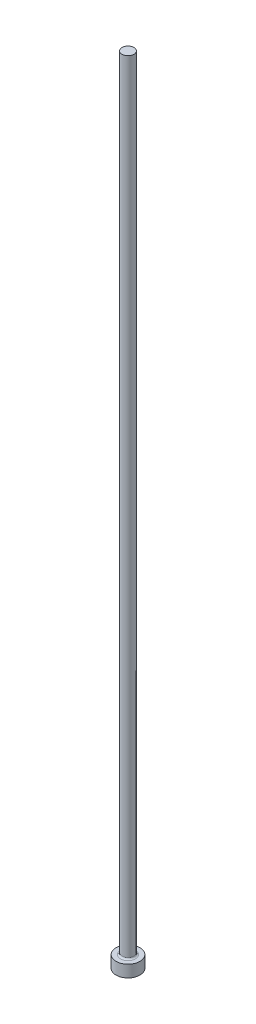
SolidWorks part; units mm, degrees
ref_plane "Plano frontal" through (0, 0, 0) normal (0, 0, 1) x (1, 0, 0)
ref_plane "Plano superior" through (0, 0, 0) normal (0, 1, 0) x (1, 0, 0)
ref_plane "Plano direito" through (0, 0, 0) normal (1, 0, 0) x (0, 0, -1)
sketch "Esboço1" plane through (0, 0, 0) normal (0, 0, 1) x (1, 0, 0)
  line L0 (0, 0) -> (1.5, 0)
  line L1 (1.5, 0) -> (1.5, 1.5)
  line L2 (1.5, 1.5) -> (0.95, 1.5)
  line L3 (0.75, 1.7) -> (0.75, 100)
  line L4 (0.75, 100) -> (0, 100)
  line L5 (0, 100) -> (0, 0) construction
  line L6 (0, 0) -> (0, 100)
  arc A0 (0.95, 1.5) -> (0.75, 1.7) centre (0.95, 1.7) cw
  dimension "D3" = 0.2
  dimension "D1" = 3
  dimension "D2" = 1.5
  dimension "D4" = 1.5
  dimension "D5" = 100
revolve "Revolução1" add sketch "Esboço1" angle 360 about L5
sketch "Esboço2"
  dimension "D1" = 0.1125
  dimension "D2" = 0.2625
  dimension "D3" = 0.1687
  dimension "D4" = 0.8063
wrap "Envolver1" sketch "Esboço2" wrap type deboss source sketch "Esboço2" thickness 0.1 parameters "D1"=0.1
